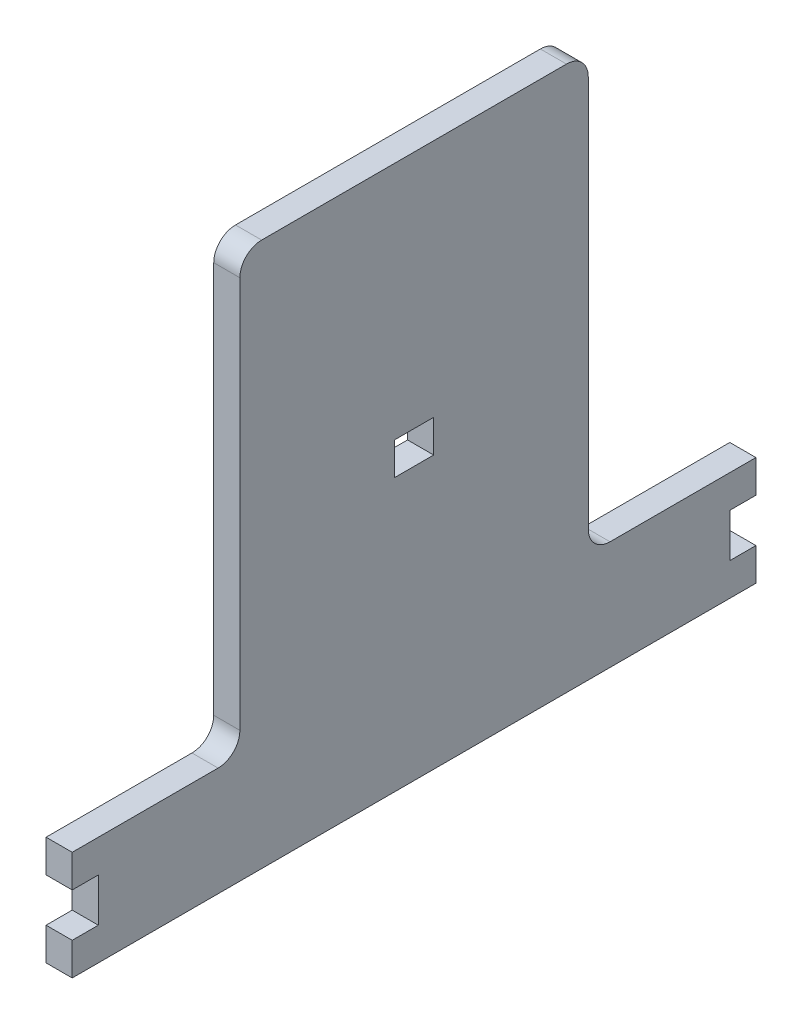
SolidWorks part; units mm, degrees
ref_plane "Front Plane" through (0, 0, 0) normal (0, 0, 1) x (1, 0, 0)
ref_plane "Top Plane" through (0, 0, 0) normal (0, 1, 0) x (1, 0, 0)
ref_plane "Right Plane" through (0, 0, 0) normal (1, 0, 0) x (0, 0, -1)
sketch "Sketch1" plane through (0, 0, 0) normal (1, 0, 0) x (0, 0, -1)
  line L0 (-157, 25) -> (-157, 10)
  line L1 (-157, 25) -> (-80, 25)
  line L3 (-157, -25) -> (157, -25)
  line L4 (157, 25) -> (157, 10)
  line L5 (-157, 10) -> (-145, 10)
  line L6 (-145, 10) -> (-145, -10)
  line L7 (-145, -10) -> (-157, -10)
  line L8 (-157, -10) -> (-157, -25)
  line L9 (157, 10) -> (145, 10)
  line L10 (145, 10) -> (145, -10)
  line L11 (145, -10) -> (157, -10)
  line L12 (157, -10) -> (157, -25)
  line L13 (80, 25) -> (157, 25)
  line L15 (-80, 25) -> (-80, 225)
  line L16 (-80, 225) -> (80, 225)
  line L17 (80, 25) -> (80, 225)
  point P14 (-145, 0)
  point P19 (0, 225)
  dimension "D1" = 12
  dimension "D2" = 20
  dimension "D3" = 15
  dimension "D4" = 314
  dimension "D5" = 160
  dimension "D6" = 200
extrude "Boss-Extrude1" add sketch "Sketch1" against normal blind 12
sketch "Sketch2" plane through (-12, 0, 0) normal (-1, 0, 0) x (0, 0, 1)
  line L0 (80, 25) -> (157, 25) construction
  line L1 (80, 225) -> (80, 25) construction
  line L2 (-80, 25) -> (-80, 225) construction
  circle A0 centre (-60.3, 129.7) radius 4.7
  circle A1 centre (60.3, 129.7) radius 4.7
  dimension "D1" = 9.4
  dimension "D2" = 104.7
  dimension "D3" = 19.7
  dimension "D4" = 19.7
extrude "Cut-Extrude1" cut sketch "Sketch2" against normal blind 5
sketch "Sketch3" plane through (-12, 0, 0) normal (-1, 0, 0) x (0, 0, 1)
  line L1 (-9, 115) -> (9, 115)
  line L2 (-9, 115) -> (-9, 100)
  line L3 (-9, 100) -> (9, 100)
  line L4 (9, 115) -> (9, 100)
  circle A0 centre (-60.3, 129.7) radius 4.7 construction
  point P4 (0, 100)
  dimension "D1" = 18
  dimension "D2" = 15
  dimension "D3" = 14.7
extrude "Cut-Extrude2" cut sketch "Sketch3" against normal blind 15
fillet "Fillet1" radius 10 4 edges at (-6, 25, 80) (-6, 25, -80) (-6, 225, 80) (-6, 225, -80)
